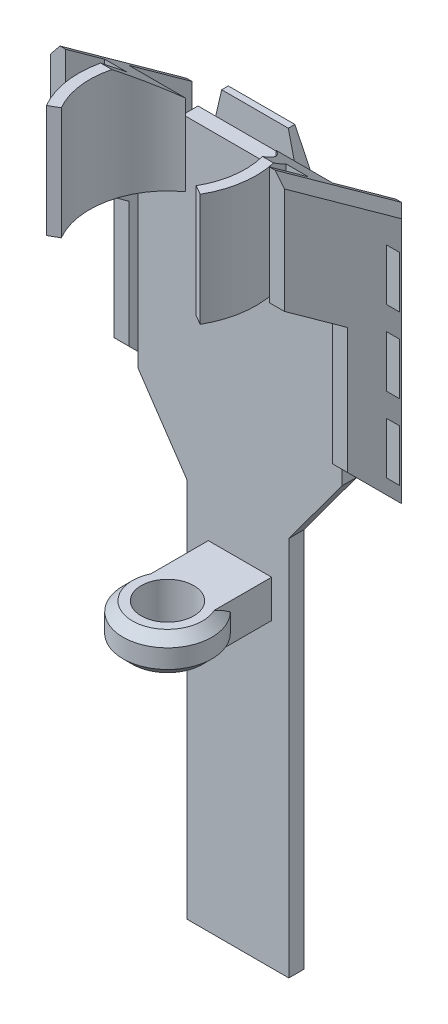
SolidWorks part; units mm, degrees
ref_plane "Front Plane" through (0, 0, 0) normal (0, 0, 1) x (1, 0, 0)
ref_plane "Top Plane" through (0, 0, 0) normal (0, 1, 0) x (1, 0, 0)
ref_plane "Right Plane" through (0, 0, 0) normal (1, 0, 0) x (0, 0, -1)
sketch "Sketch1" plane through (0, 0, 0) normal (0, 1, 0) x (1, 0, 0)
  line L2 (-8.43, 8.3052) -> (-8.43, 19.3052)
  line L3 (-8.43, 19.3052) -> (8.43, 19.3052)
  line L4 (8.43, 8.3052) -> (8.43, 19.3052)
  circle A0 centre (0, 0) radius 7
  arc A1 (-8.43, 8.3052) -> (8.43, 8.3052) centre (0, 0) ccw
  point P4 (0, 11.8339)
extrude "Boss-Extrude1" add sketch "Sketch1" along normal blind 10
chamfer "Chamfer1" distance 2.5 angle 45 2 edges at (0, 0, 11.8339) (0, 10, 11.8339)
sketch "Sketch2" plane through (0, 0, -19.3052) normal (0, 0, -1) x (-1, 0, 0)
  line L0 (-8.43, 10) -> (8.43, 10) construction
  line L1 (14.1308, -15.1547) -> (27.1311, -15.1547)
  line L2 (-27.1311, -15.1547) -> (-27.1311, 119.3702)
  line L3 (-27.1311, 119.3702) -> (27.1311, 119.3702)
  line L4 (27.1311, -15.1547) -> (27.1311, 119.3702)
  line L7 (-27.1311, -15.1547) -> (-13.0003, -15.1547)
  line L8 (-13.0003, -15.1547) -> (-13.0003, -80.1563)
  line L9 (-13.0003, -80.1563) -> (14.1308, -80.1563)
  line L10 (14.1308, -15.1547) -> (14.1308, -80.1563)
  point P0 (0, 10)
extrude "Boss-Extrude2" add sketch "Sketch2" along normal blind 4
sketch "Sketch3" plane through (0, 0, -23.3052) normal (0, 0, -1) x (-1, 0, 0)
  line L0 (14.1308, -15.1547) -> (14.1308, 21.2108)
  line L1 (14.1308, 21.2108) -> (27.1311, 40.3989)
  line L2 (27.1311, -15.1547) -> (27.1311, 119.3702) construction
  line L3 (-13.0003, -15.1547) -> (-13.0003, 21.2108)
  line L4 (-13.0003, 21.2108) -> (-27.1311, 40.3989)
  line L5 (-27.1311, 119.3702) -> (-27.1311, -15.1547) construction
  line L6 (-27.1311, 40.3989) -> (-27.1311, -15.1547)
  line L7 (-27.1311, -15.1547) -> (-13.0003, -15.1547)
  line L8 (14.1308, -15.1547) -> (27.1311, -15.1547)
  line L9 (27.1311, -15.1547) -> (27.1311, 40.3989)
extrude "Cut-Extrude1" cut sketch "Sketch3" against normal blind 14
sketch "Sketch4" plane through (0, 0, -23.3052) normal (0, 0, -1) x (-1, 0, 0)
  line L0 (-27.1311, 104.8711) -> (27.1311, 104.8711)
  line L1 (-27.1311, 119.3702) -> (-27.1311, 40.3989) construction
  line L2 (27.1311, 40.3989) -> (27.1311, 119.3702) construction
  line L3 (27.1311, 104.8711) -> (27.1311, 119.3702)
  line L4 (27.1311, 119.3702) -> (-27.1311, 119.3702) construction
  line L5 (27.1311, 119.3702) -> (-27.1311, 119.3702)
  line L6 (-27.1311, 119.3702) -> (-27.1311, 101.3157)
extrude "Cut-Extrude2" cut sketch "Sketch4" against normal blind 14 contours L0 M1 M7 M8
sketch "Sketch5" plane through (27.1311, 0, 0) normal (1, 0, 0) x (0, 0, -1)
  line L0 (33.7205, 99.3304) -> (0, 123.6242)
  line L1 (0, 123.6242) -> (0, 92.298)
  line L2 (0, 92.298) -> (16.8602, 80.1511)
  line L3 (16.8602, 80.1511) -> (16.8602, 60.6521)
  line L4 (16.8602, 60.6521) -> (16.8602, 46.6929)
  line L5 (33.7205, 48.5052) -> (33.7205, 99.3304)
  line L6 (16.8602, 46.6929) -> (33.7205, 29.8327)
  line L7 (33.7205, 29.8327) -> (33.7205, 48.5052)
extrude "Boss-Extrude3" add sketch "Sketch5" along normal blind 4
sketch "Sketch6" plane through (-27.1311, 0, 0) normal (-1, 0, 0) x (0, 0, 1)
  line L0 (-16.8602, 46.6929) -> (-33.7205, 29.8327)
  line L1 (-33.7205, 29.8327) -> (-33.7205, 99.3304)
  line L2 (-33.7205, 99.3304) -> (0, 123.6242)
  line L3 (0, 123.6242) -> (0, 92.298)
  line L4 (0, 92.298) -> (-16.8602, 80.1511)
  line L5 (-16.8602, 80.1511) -> (-16.8602, 46.6929)
extrude "Boss-Extrude4" add sketch "Sketch6" along normal blind 4
sketch "Sketch7" plane through (0, 0, -23.3052) normal (0, 0, -1) x (-1, 0, 0)
  line L0 (-16.2269, 104.8711) -> (-27.1311, 90.6591)
  line L1 (-27.1311, 104.8711) -> (27.1311, 104.8711) construction
  line L2 (-27.1311, 104.8711) -> (-27.1311, 40.3989) construction
  line L3 (-27.1311, 90.6591) -> (-27.1311, 104.8711)
  line L4 (-27.1311, 104.8711) -> (-16.2269, 104.8711)
  line L5 (15.1758, 104.8711) -> (27.1311, 90.6591)
  line L6 (27.1311, 40.3989) -> (27.1311, 104.8711) construction
  line L7 (27.1311, 90.6591) -> (27.1311, 104.8711)
  line L8 (27.1311, 104.8711) -> (15.1758, 104.8711)
extrude "Cut-Extrude3" cut sketch "Sketch7" against normal blind 4
sketch "Sketch8" plane through (-31.1311, 0, 0) normal (-1, 0, 0) x (0, 0, 1)
  line L0 (-30.6737, 36.816) -> (-27.2372, 40.2524)
  line L1 (-27.2372, 40.2524) -> (-27.2372, 53.9984)
  line L2 (-27.2372, 53.9984) -> (-30.6737, 50.5619)
  line L3 (-30.6737, 50.5619) -> (-30.6737, 36.816)
extrude "Cut-Extrude4" cut sketch "Sketch8" against normal blind 83
pattern_linear "LPattern2" count 3 spacing 20 along (0, 1, 0) of "Cut-Extrude4"
ref_plane "Plane1" through (0, 89.8711, 0) normal (0, 1, 0) x (1, 0, 0)
sketch "Sketch11" plane through (0, 89.8711, 0) normal (0, 1, 0) x (1, 0, 0)
  line L0 (-27.1311, 16.8602) -> (-12.0462, 16.8602)
  line L1 (-27.1311, 0) -> (-27.1311, 33.7205) construction
  line L2 (27.1311, 33.7205) -> (27.1311, 0) construction
  line L3 (-27.1311, 16.8602) -> (-27.1311, 10.3858)
  line L4 (-27.1311, 10.3858) -> (-21.2185, 10.3858)
  line L5 (27.1311, 10.3858) -> (27.1311, 16.8602)
  line L6 (-20.4837, -11.7689) -> (-17.9671, -10.3229)
  line L7 (17.9671, -10.3229) -> (20.4837, -11.7689)
  line L8 (12.0462, 16.8602) -> (27.1311, 16.8602)
  line L9 (21.2185, 10.3858) -> (27.1311, 10.3858)
  arc A0 (20.4837, -11.7689) -> (21.2185, 10.3858) centre (0, 0) ccw
  arc A1 (17.9671, -10.3229) -> (12.0462, 16.8602) centre (0, 0) ccw
  arc A2 (-21.2185, 10.3858) -> (-20.4837, -11.7689) centre (0, 0) ccw
  arc A3 (-12.0462, 16.8602) -> (-17.9671, -10.3229) centre (0, 0) ccw
extrude "Boss-Extrude6" add sketch "Sketch11" along normal blind 30
sketch "Sketch12" plane through (31.1311, 0, 0) normal (1, 0, 0) x (0, 0, -1)
  line L0 (16.8602, 111.4773) -> (5.2364, 119.8517)
  line L1 (33.7205, 99.3304) -> (0, 123.6242) construction
  line L2 (5.2364, 119.8517) -> (16.8602, 119.8711)
  line L3 (16.8602, 119.8711) -> (16.8602, 111.4773)
  line L4 (5.2364, 119.8517) -> (5.2364, 123.8084)
  line L5 (5.2364, 123.8084) -> (16.8602, 123.8084)
  line L6 (16.8602, 123.8084) -> (16.8602, 119.8711)
extrude "Cut-Extrude7" cut sketch "Sketch12" against normal blind 73 contours L3 L2 M13 | L6 L5 L4 L2
sketch "Sketch13" plane through (0, 0, -23.3052) normal (0, 0, -1) x (-1, 0, 0)
  line L0 (2.2, 89.8711) -> (-2.2, 89.8711) construction
  line L1 (-16.133, 62.5062) -> (-16.133, 34.669)
  line L2 (-16.133, 62.5062) -> (-16.133, 80.7117)
  line L3 (-16.133, 34.669) -> (-8.8692, 22.9443)
  line L4 (16.133, 62.5062) -> (16.133, 80.7117)
  line L5 (-8.8692, 111.7681) -> (8.8692, 111.7681)
  line L6 (8.8692, 111.7681) -> (16.133, 80.7117)
  line L8 (-8.8692, 22.9443) -> (8.8692, 22.9443)
  line L9 (-8.8692, 111.7681) -> (-16.133, 80.7117)
  line L10 (8.8692, 22.9443) -> (16.133, 34.669)
  line L11 (16.133, 34.669) -> (16.133, 62.5062)
  point P0 (0, 89.8711)
extrude "Boss-Extrude7" add sketch "Sketch13" along normal blind 7
sketch "Sketch14" plane through (-16.133, 0, 0) normal (-1, 0, 0) x (0, 0, 1)
  line L0 (-25.058, 111.7681) -> (-30.3052, 80.7117)
  line L1 (-30.3052, 111.7681) -> (-23.3052, 111.7681) construction
  line L2 (-30.3052, 80.7117) -> (-30.3052, 111.7681)
  line L3 (-30.3052, 111.7681) -> (-25.058, 111.7681)
extrude "Cut-Extrude8" cut sketch "Sketch14" against normal blind 33
chamfer "Chamfer2" distance 2.5 angle 45 4 edges at (31.1311, 64.5816, -33.7205) (31.1311, 111.4773, -16.8602) (-31.1311, 64.5816, -33.7205) (-31.1311, 111.4773, -16.8602)
